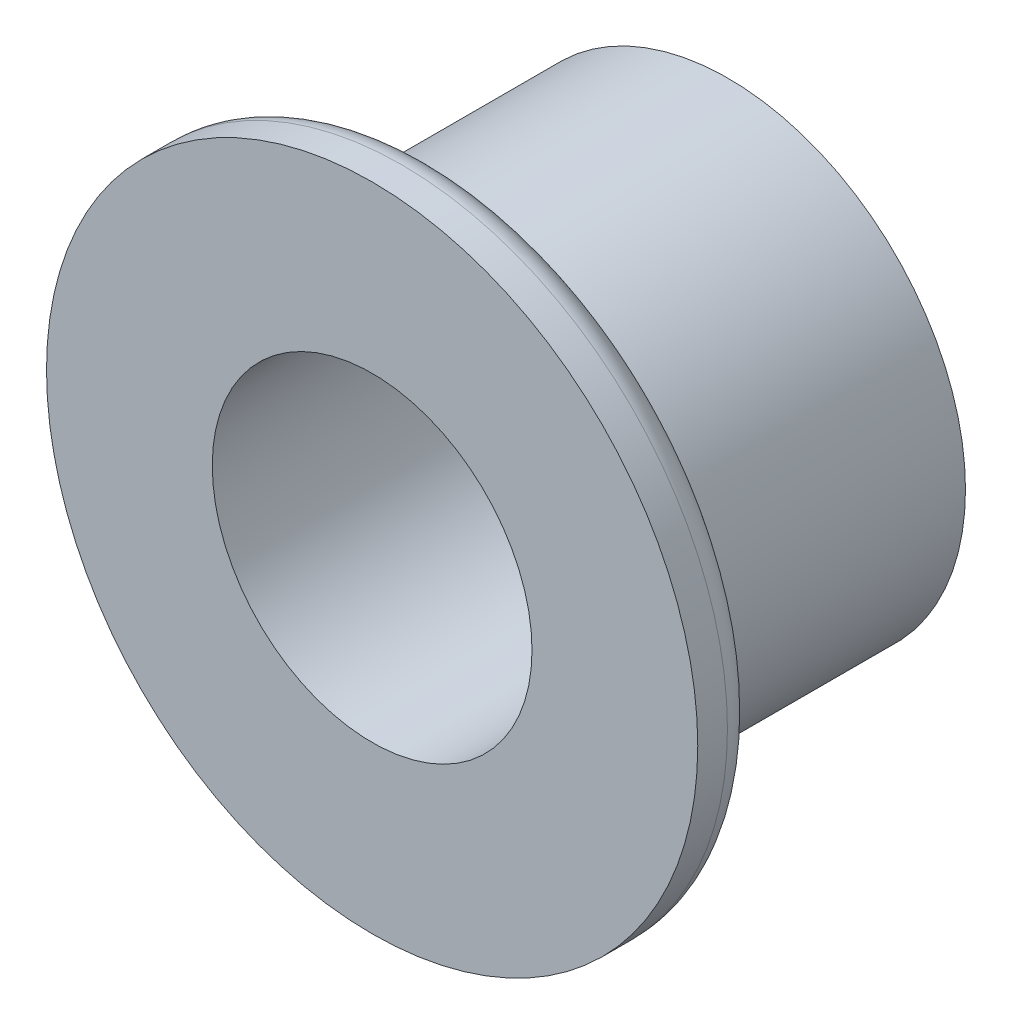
SolidWorks part; units mm, degrees
ref_plane "Front Plane" through (0, 0, 0) normal (0, 0, 1) x (1, 0, 0)
ref_plane "Top Plane" through (0, 0, 0) normal (0, 1, 0) x (1, 0, 0)
ref_plane "Right Plane" through (0, 0, 0) normal (1, 0, 0) x (0, 0, -1)
sketch "Sketch1" plane through (0, 0, 0) normal (0, 0, 1) x (1, 0, 0)
  circle A1 centre (0, 0) radius 3.422
  circle A2 centre (0, 0) radius 5.08
extrude "Boss-Extrude1" add sketch "Sketch1" along normal blind 6.35
sketch "Sketch2" plane through (0, 0, 6.35) normal (0, 0, 1) x (1, 0, 0)
  circle A0 centre (0, 0) radius 3.422 construction
  circle A1 centre (0, 0) radius 3.422
  circle A2 centre (0, 0) radius 6.9697
extrude "Boss-Extrude2" add sketch "Sketch2" along normal blind 1.27
fillet "Fillet1" radius 0.635 2 edges at (6.9697, 0, 6.35) (5.08, 0, 6.35)
